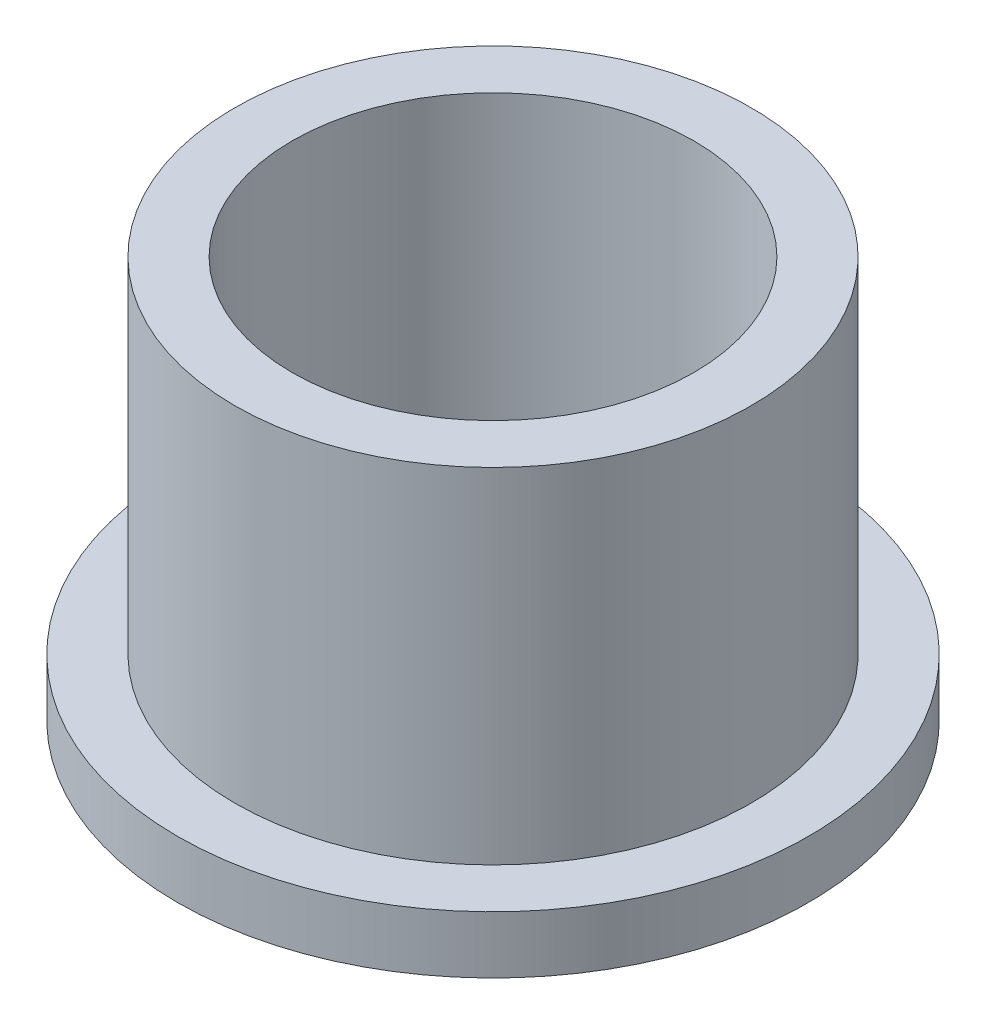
SolidWorks part; units mm, degrees
ref_plane "Front" through (0, 0, 0) normal (0, 0, 1) x (1, 0, 0)
ref_plane "Top" through (0, 0, 0) normal (0, 1, 0) x (1, 0, 0)
ref_plane "Right" through (0, 0, 0) normal (1, 0, 0) x (0, 0, -1)
sketch "Sketch1" plane through (0, 0, 0) normal (0, 1, 0) x (1, 0, 0)
  circle A0 centre (0, 0) radius 7
  circle A1 centre (0, 0) radius 9
  circle A2 centre (0, 0) radius 11
  dimension "ID" = 14
  dimension "OD" = 18
  dimension "FlangeOD" = 22
sketch "Sketch2" plane through (0, 0, 0) normal (0, 1, 0) x (1, 0, 0)
  circle A0 centre (0, 0) radius 7 construction
  circle A1 centre (0, 0) radius 9 construction
  circle A2 centre (0, 0) radius 7
  circle A3 centre (0, 0) radius 9
extrude "Boss-Extrude1" add sketch "Sketch2" along normal blind 14
sketch "Sketch3" plane through (0, 0, 0) normal (0, 1, 0) x (1, 0, 0)
  circle A0 centre (0, 0) radius 11 construction
  circle A1 centre (0, 0) radius 9 construction
  circle A2 centre (0, 0) radius 11
  circle A3 centre (0, 0) radius 9
extrude "Boss-Extrude2" add sketch "Sketch3" along normal blind 2
